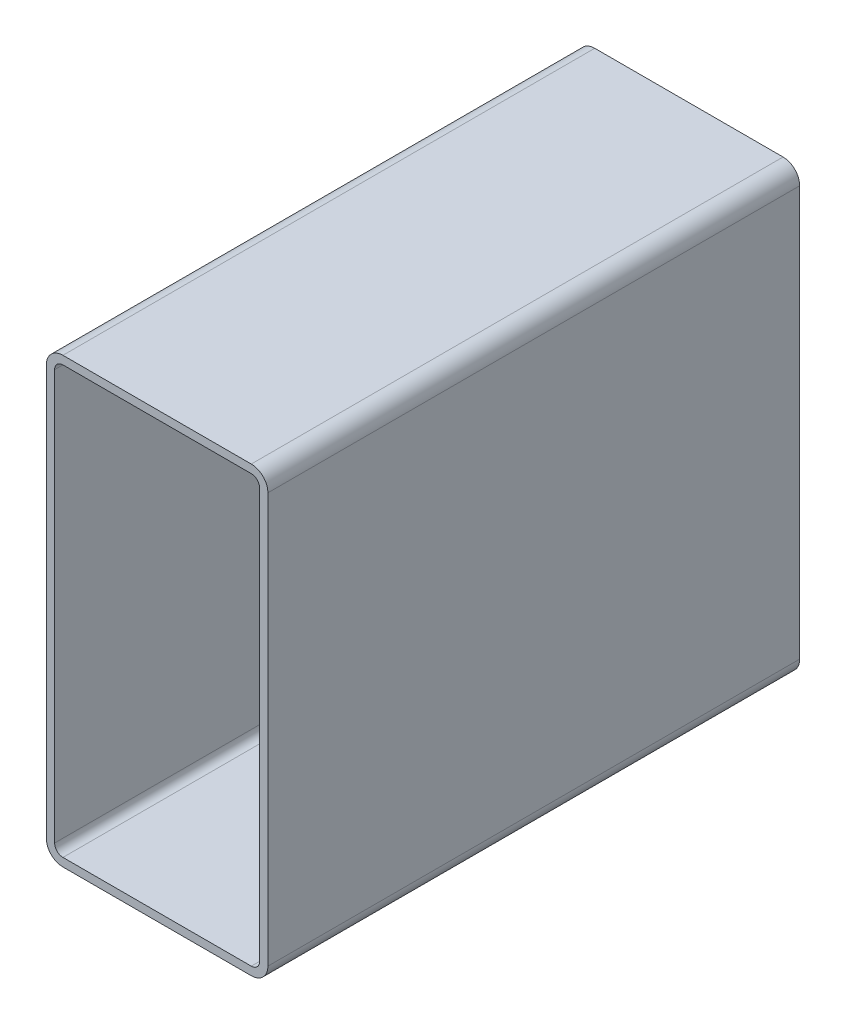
SolidWorks part; units mm, degrees
ref_plane "Front Plane" through (0, 0, 0) normal (0, 0, 1) x (1, 0, 0)
ref_plane "Top Plane" through (0, 0, 0) normal (0, 1, 0) x (1, 0, 0)
ref_plane "Right Plane" through (0, 0, 0) normal (1, 0, 0) x (0, 0, -1)
sketch "Sketch1" plane through (0, 0, 0) normal (0, 0, 1) x (1, 0, 0)
sketch_block_instance "HSS10x5x0.1875-1"
sketch_block "HSS10x5x0.1875"
extrude "Boss-Extrude1" add sketch "Sketch1" along normal blind 304.8
